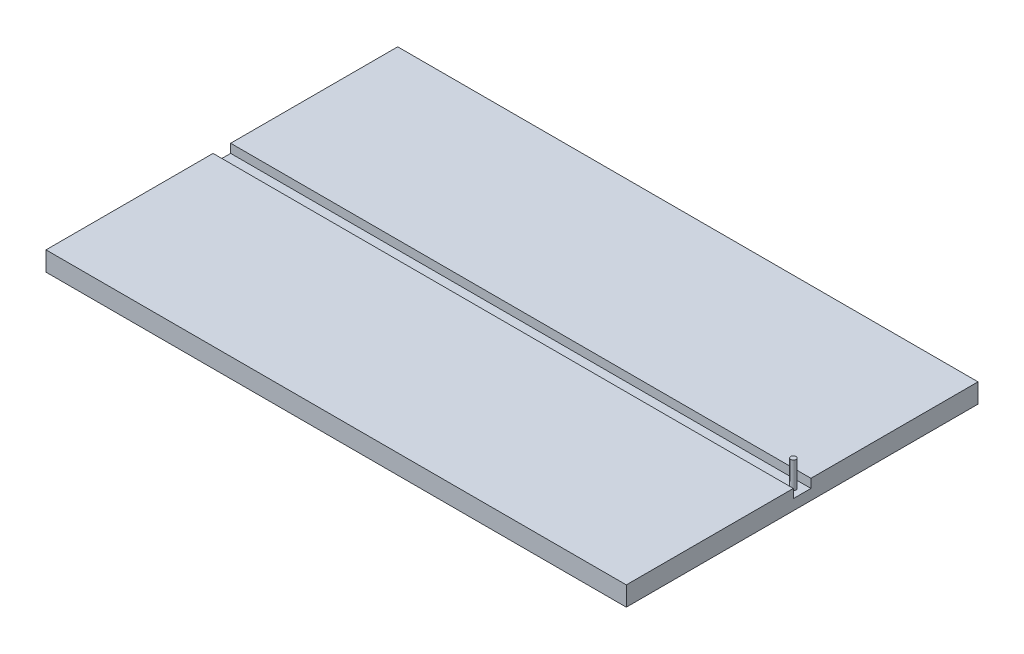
SolidWorks part; units mm, degrees
ref_plane "Front Plane" through (0, 0, 0) normal (0, 0, 1) x (1, 0, 0)
ref_plane "Top Plane" through (0, 0, 0) normal (0, 1, 0) x (1, 0, 0)
ref_plane "Right Plane" through (0, 0, 0) normal (1, 0, 0) x (0, 0, -1)
sketch "Sketch1" plane through (0, 0, 0) normal (0, 1, 0) x (1, 0, 0)
  line L1 (0, 0) -> (330, 0)
  line L2 (0, 0) -> (0, 200)
  line L3 (0, 200) -> (330, 200)
  line L4 (330, 0) -> (330, 200)
  dimension "D1" = 330
extrude "Boss-Extrude1" add sketch "Sketch1" along normal blind 6
sketch "Sketch2" plane through (0, 6, 0) normal (0, 1, 0) x (1, 0, 0)
  line L0 (330, 0) -> (330, 200) construction
  line L1 (0, 0) -> (330, 0)
  line L2 (0, 0) -> (0, 95)
  line L3 (0, 95) -> (330, 95)
  line L4 (330, 0) -> (330, 95)
  line L6 (0, 200) -> (330, 200)
  line L7 (0, 200) -> (0, 105)
  line L8 (0, 105) -> (330, 105)
  line L9 (330, 200) -> (330, 105)
extrude "Boss-Extrude2" add sketch "Sketch2" along normal blind 5
sketch "Sketch3" plane through (0, 6, 0) normal (0, 1, 0) x (1, 0, 0)
  line L0 (0, 105) -> (330, 105) construction
  line L1 (330, 95) -> (330, 105) construction
  circle A0 centre (325, 100) radius 1.5
  dimension "D1" = 5
  dimension "D2" = 5
extrude "Boss-Extrude3" add sketch "Sketch3" along normal blind 15
